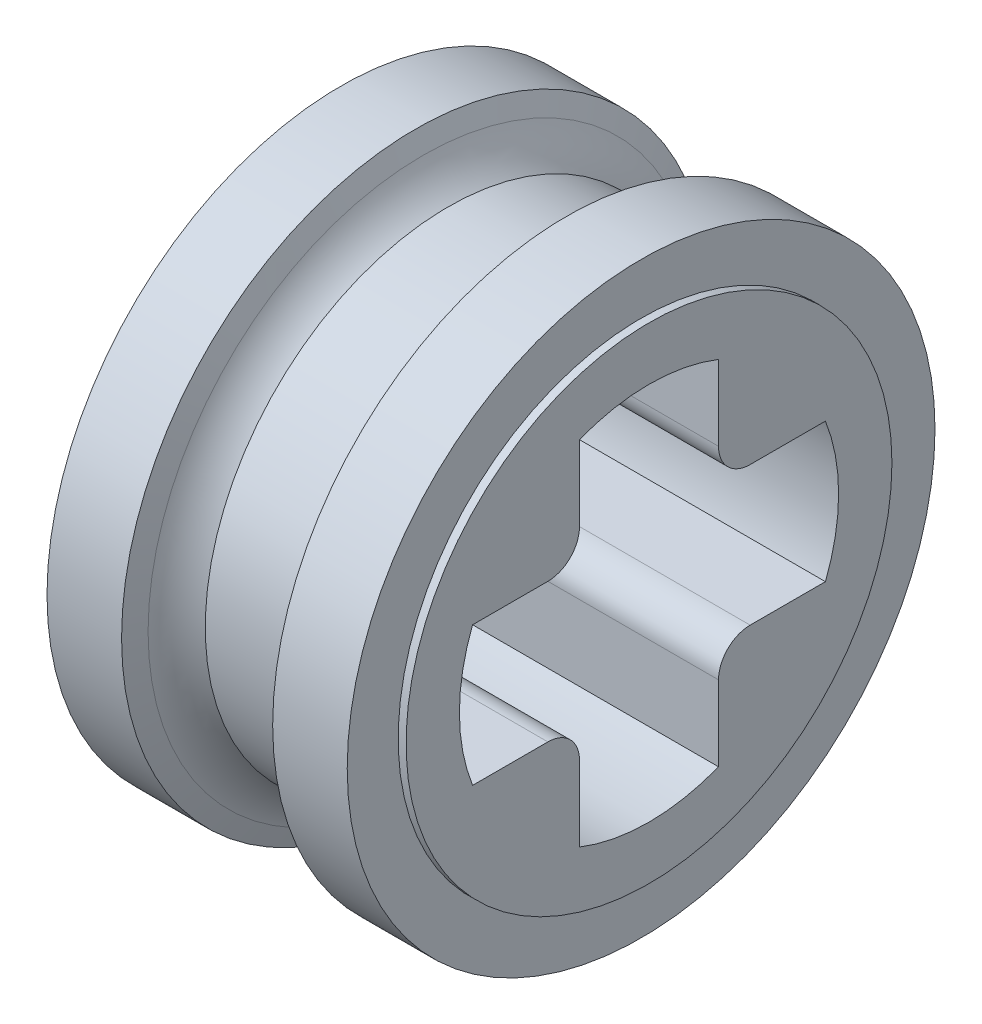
SolidWorks part; units mm, degrees
ref_plane "Front Plane" through (0, 0, 0) normal (0, 0, 1) x (1, 0, 0)
ref_plane "Top Plane" through (0, 0, 0) normal (0, 1, 0) x (1, 0, 0)
ref_plane "Right Plane" through (0, 0, 0) normal (1, 0, 0) x (0, 0, -1)
imported_body "Imported1"
sketch "Sketch1" plane through (2.0162, 0, 0) normal (1, 0, 0) x (0, 0, -1)
  circle A0 centre (0, 0) radius 3.075
extrude "Boss-Extrude1" add sketch "Sketch1" against normal up to surface (4.0325 mm away)
sketch "Sketch2" plane through (2.0162, 0, 0) normal (1, 0, 0) x (0, 0, -1)
  line L0 (-0.88, 2.2328) -> (-0.88, 1.28)
  line L1 (0.88, -2.2328) -> (0.88, -1.28)
  line L2 (2.2328, 0.88) -> (1.28, 0.88)
  line L3 (-2.2328, -0.88) -> (-1.28, -0.88)
  line L4 (-0.88, -1.28) -> (-0.88, -2.2328)
  line L5 (-1.28, 0.88) -> (-2.2328, 0.88)
  line L6 (0.88, 1.28) -> (0.88, 2.2328)
  line L7 (1.28, -0.88) -> (2.2328, -0.88)
  arc A0 (-2.2328, 0.88) -> (-2.2328, -0.88) centre (0, 0) ccw
  arc A1 (0.88, 2.2328) -> (-0.88, 2.2328) centre (0, 0) ccw
  arc A2 (2.2328, -0.88) -> (2.2328, 0.88) centre (0, 0) ccw
  arc A3 (-0.88, -2.2328) -> (0.88, -2.2328) centre (0, 0) ccw
  arc A4 (1.28, 0.88) -> (0.88, 1.28) centre (1.28, 1.28) cw
  arc A5 (0.88, -1.28) -> (1.28, -0.88) centre (1.28, -1.28) cw
  arc A6 (-0.88, -1.28) -> (-1.28, -0.88) centre (-1.28, -1.28) ccw
  arc A7 (-0.88, 1.28) -> (-1.28, 0.88) centre (-1.28, 1.28) cw
  point P16 (0.88, 0.88)
  point P19 (0.88, -0.88)
  point P24 (-0.88, 0.88)
  dimension "D1" = 0.88
  dimension "D5" = 4.8
  dimension "D6" = 0.4
  dimension "D2" = 1.76
  dimension "D3" = 0.88
  dimension "D4" = 1.76
extrude "Cut-Extrude1" cut sketch "Sketch2" against normal through all
sketch "Sketch6" plane through (1.9163, 0, 0) normal (1, 0, 0) x (0, 0, -1)
  circle A0 centre (0, 0) radius 3.72
  circle A1 centre (0, 0) radius 3.075
extrude "Cut-Extrude5" cut sketch "Sketch6" against normal blind 0.0162
sketch "Sketch7" plane through (2.0162, 0, 0) normal (1, 0, 0) x (0, 0, -1)
  circle A0 centre (0, 0) radius 3.075
extrude "Cut-Extrude6" cut sketch "Sketch7" against normal blind 0.0162
mirror "Mirror2" about plane through (0, 0, 0) normal (1, 0, 0) of "Cut-Extrude5", "Cut-Extrude6"
